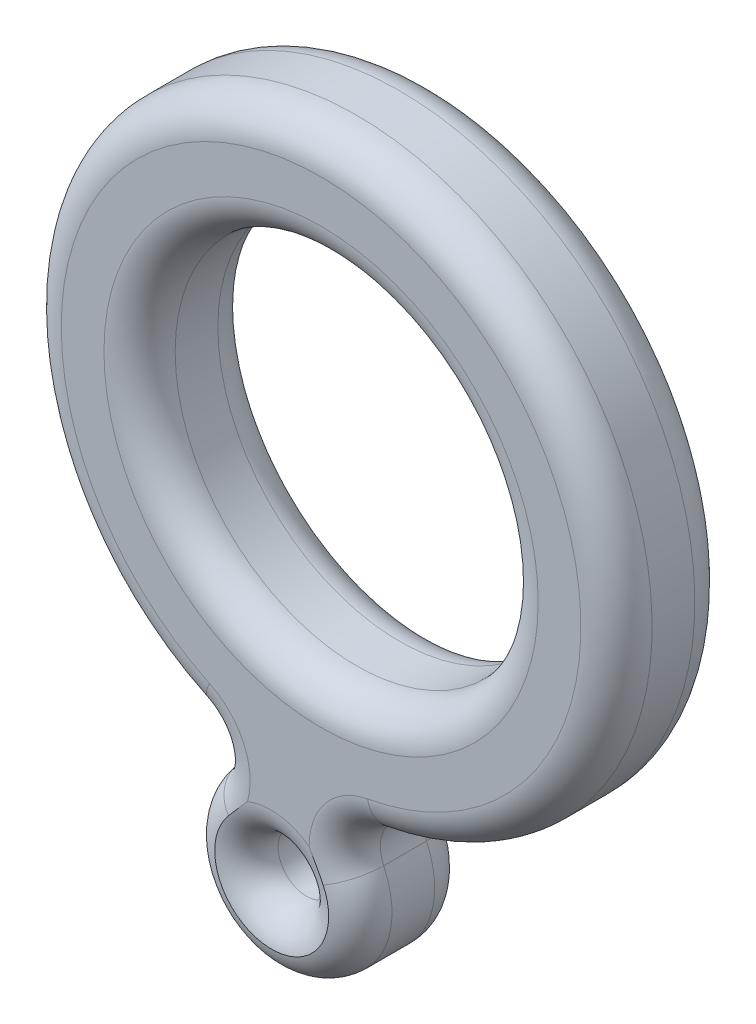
SolidWorks part; units mm, degrees
ref_plane "Спереди" through (0, 0, 0) normal (0, 0, 1) x (1, 0, 0)
ref_plane "Сверху" through (0, 0, 0) normal (0, 1, 0) x (1, 0, 0)
ref_plane "Справа" through (0, 0, 0) normal (1, 0, 0) x (0, 0, -1)
sketch "Эскиз1" plane through (0, 0, 0) normal (0, 0, 1) x (1, 0, 0)
  line L0 (0, 0) -> (-3.5193, -26.5175) construction
  line L1 (0, 0) -> (0, -62.6843) construction
  circle A0 centre (0, 0) radius 12.75
  arc A1 (3.7131, -20.4151) -> (-8.9097, -18.7398) centre (0, 0) ccw
  circle A2 centre (-3.5193, -26.5175) radius 2
  arc A3 (-8.082, -22.6211) -> (1.9017, -23.9461) centre (-3.5193, -26.5175) ccw
  arc A4 (-8.082, -22.6211) -> (-8.9097, -18.7398) centre (-9.9832, -20.9976) ccw
  arc A5 (3.7131, -20.4151) -> (1.9017, -23.9461) centre (4.1605, -22.8747) ccw
  dimension "D1" = 25.5
  dimension "D2" = 41.5
  dimension "D3" = 4
  dimension "D4" = 12
  dimension "D5" = 5
  dimension "D6" = 7.56
extrude "Бобышка-Вытянуть1" add sketch "Эскиз1" along normal blind 8
fillet "Скругление1" radius 2.5 12 edges at (-1.5193, -26.5175, 0) (2.73, 20.5696, 0) (-7.5381, -20.4762, 0) (-4.3087, -32.4653, 0) (1.9361, -21.7336, 0) (12.75, 0, 0) (-1.5193, -26.5175, 8) (-4.3087, -32.4653, 8) (-7.5381, -20.4762, 8) (2.73, 20.5696, 8) (1.9361, -21.7336, 8) (12.75, 0, 8)
